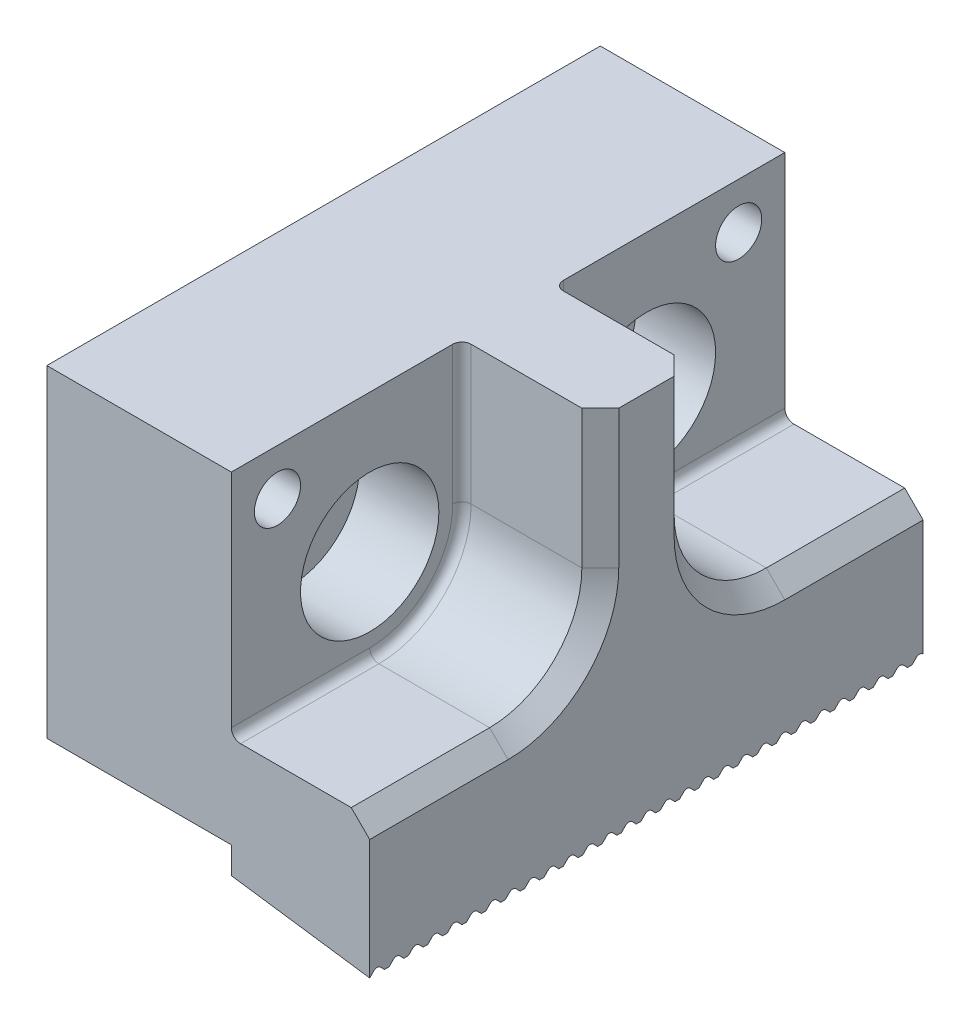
SolidWorks part; units mm, degrees
ref_plane "前视基准面" through (0, 0, 0) normal (0, 0, 1) x (1, 0, 0)
ref_plane "上视基准面" through (0, 0, 0) normal (0, 1, 0) x (1, 0, 0)
ref_plane "右视基准面" through (0, 0, 0) normal (1, 0, 0) x (0, 0, -1)
other "Configuration Table"
sketch "草图1" plane through (0, 0, 0) normal (0, 0, 1) x (1, 0, 0)
  line L0 (-10.4354, -13.2525) -> (-10.4354, 21.7475)
  line L1 (-10.4354, 21.7475) -> (24.5646, 21.7475)
  line L2 (24.5646, 21.7475) -> (24.5646, -18.2525)
  line L3 (24.5646, -18.2525) -> (9.5646, -16.1444)
  line L4 (9.5646, -16.1444) -> (9.5646, -13.2525)
  line L5 (9.5646, -13.2525) -> (-10.4354, -13.2525)
  dimension "D1" = 35
  dimension "D2" = 35
  dimension "D3" = 40
  dimension "D4" = 8
  dimension "D5" = 15
extrude "凸台-拉伸1" add sketch "草图1" along normal blind 60
sketch "草图2" plane through (24.5646, 0, 0) normal (1, 0, 0) x (0, 0, -1)
  line L1 (-60, 21.7475) -> (-35, 21.7475)
  line L2 (-60, 21.7475) -> (-60, -3.2525)
  line L3 (-60, -3.2525) -> (-45, -3.2525)
  line L4 (-35, 21.7475) -> (-35, 6.7475)
  line L5 (0, 21.7475) -> (-25, 21.7475)
  line L6 (0, 21.7475) -> (0, -3.2525)
  line L7 (0, -3.2525) -> (-15, -3.2525)
  line L8 (-25, 21.7475) -> (-25, 6.7475)
  arc A0 (-15, -3.2525) -> (-25, 6.7475) centre (-15, 6.7475) cw
  arc A1 (-45, -3.2525) -> (-35, 6.7475) centre (-45, 6.7475) ccw
  point P12 (-25, -3.2525)
  dimension "D5" = 10
  dimension "D1" = 10
  dimension "D2" = 25
  dimension "D3" = 25
  dimension "D4" = 25
extrude "切除-拉伸1" cut sketch "草图2" against normal blind 15
sketch "草图3" plane through (9.5646, 0, 0) normal (1, 0, 0) x (0, 0, -1)
  line L0 (0, -3.2525) -> (0, 21.7475) construction
  line L1 (-15, -3.2525) -> (0, -3.2525) construction
  line L2 (-25, 21.7475) -> (-25, 6.7475) construction
  line L3 (0, 21.7475) -> (-25, 21.7475) construction
  line L4 (0, -3.2525) -> (0, 21.7475) construction
  line L5 (-15, -3.2525) -> (0, -3.2525) construction
  line L6 (-25, 21.7475) -> (-25, 6.7475) construction
  line L7 (0, 21.7475) -> (-25, 21.7475) construction
  line L12 (-60, 21.7475) -> (-60, -3.2525)
  line L13 (-60, -3.2525) -> (-45, -3.2525)
  line L14 (-35, 6.7475) -> (-35, 21.7475)
  line L15 (-35, 21.7475) -> (-60, 21.7475)
  line L16 (-60, 21.7475) -> (-60, -3.2525) construction
  line L17 (-60, -3.2525) -> (-45, -3.2525) construction
  line L18 (-35, 6.7475) -> (-35, 21.7475) construction
  line L19 (-35, 21.7475) -> (-60, 21.7475) construction
  arc A0 (-25, 6.7475) -> (-15, -3.2525) centre (-15, 6.7475) ccw construction
  arc A1 (-25, 6.7475) -> (-15, -3.2525) centre (-15, 6.7475) ccw construction
  arc A3 (-45, -3.2525) -> (-35, 6.7475) centre (-45, 6.7475) ccw
  arc A4 (-45, -3.2525) -> (-35, 6.7475) centre (-45, 6.7475) ccw construction
  dimension "D1" = 0
hole_wizard "M8 六角凹头螺钉的柱形沉头孔1" positions "3D草图1" profile "草图4" counterbore size "M8" standard "ISO"
sketch3d "3D草图1"
  point P0 (9.5646, 6.7475, 15)
  point P3 (9.5646, 6.7475, 45)
sketch "草图4" plane through (9.5646, 6.7475, 15) normal (0, 1, 0) x (0, 0, -1)
  line L0 (0, 0) -> (0, 20)
  line L1 (0, 20) -> (4.5, 20)
  line L3 (4.5, 20) -> (4.5, 8.6)
  line L4 (4.5, 8.6) -> (7.5, 8.6)
  line L5 (7.5, 8.6) -> (7.5, 0)
  line L7 (7.5, 0) -> (0, 0)
  line L11 (0, -6.35) -> (0, 107.95) construction
  dimension "通孔孔直径" = 9
  dimension "通孔孔深度" = 20
  dimension "柱形沉头孔直径" = 15
  dimension "柱形沉头孔深度" = 8.6
hole_wizard "M6 螺纹孔的螺纹孔钻头1" positions "3D草图2" profile "草图5" hole size "M6" standard "ISO"
sketch3d "3D草图2"
  line L0 (9.5646, 21.7475, 0) -> (9.5646, 21.7475, 25) construction
  line L1 (9.5646, 21.7475, 60) -> (9.5646, -3.2525, 60) construction
  line L2 (9.5646, 21.7475, 35) -> (9.5646, 21.7475, 60) construction
  point P0 (9.5646, 16.7475, 5)
  point P2 (9.5646, 16.7475, 55)
  dimension "D1" = 5
  dimension "D2" = 5
  dimension "D3" = 5
  dimension "D4" = 50
sketch "草图5" plane through (9.5646, 16.7475, 5) normal (0, 1, 0) x (0, 0, -1)
  line L0 (0, 0) -> (0, 20)
  line L1 (0, 20) -> (2.5, 20)
  line L2 (2.5, 20) -> (2.5, 0)
  line L5 (2.5, 0) -> (0, 0)
  line L11 (0, -6.35) -> (0, 107.95) construction
  dimension "通孔孔直径" = 5
  dimension "通孔孔深度" = 20
ref_plane "基准面1" through (26.6043, -3.739, 0) normal (-0.9903, 0.1392, 0) x (0, 0, -1)
sketch "草图6" plane through (26.6043, -3.739, 0) normal (-0.9903, 0.1392, 0) x (0, 0, -1)
  line L0 (-58.4, 14.6561) -> (-60, 14.6561)
  line L1 (-60, 14.6561) -> (0, 14.6561) construction
  line L2 (-58.8464, 14.2097) -> (-58.4, 14.6561)
  line L3 (-59.5536, 14.2097) -> (-60, 14.6561)
  line L4 (-60, 14.6561) -> (-60, -0.1979) construction
  arc A0 (-58.8464, 14.2097) -> (-59.5536, 14.2097) centre (-59.2, 14.5632) cw
  dimension "D2" = 0.5
  dimension "D1" = 0.8
  dimension "D3" = 1.6
  dimension "D4" = 90
sketch "草图7" plane through (24.5646, 0, 0) normal (1, 0, 0) x (0, 0, -1)
  line L3 (-60, -18.2525) -> (-58.4, -18.2525)
  line L4 (-58.4, -18.2525) -> (-58.8464, -17.8017)
  line L5 (-59.5536, -17.8017) -> (-60, -18.2525)
  line L6 (-60, -18.2525) -> (-58.4, -18.2525)
  line L7 (-58.4, -18.2525) -> (-58.8464, -17.8017)
  line L8 (-59.5536, -17.8017) -> (-60, -18.2525)
  ellipse E1 centre (-59.2, -18.1587) end of major axis (-59.2, -18.6636) minor radius 0.5 (-58.8464, -17.8017) -> (-59.5536, -17.8017) ccw
  ellipse E2 centre (-59.2, -18.1587) end of major axis (-59.2, -18.6636) minor radius 0.5 (-58.8464, -17.8017) -> (-59.5536, -17.8017) ccw
  dimension "D1" = 0
extrude "切除-拉伸2" cut sketch "草图7" along direction (-0.9903, 0.1392, 0) on the side against the normal up to next (15 mm away)
pattern_linear "阵列(线性)1" count 29 spacing 2.1 along (0, 0, -1) of "切除-拉伸2"
chamfer "倒角1" distance 2 angle 45 6 edges at (24.5646, -3.2525, 7.5) (24.5646, -0.3236, 22.0711) (24.5646, 14.2475, 25) (24.5646, -3.2525, 52.5) (24.5646, -0.3236, 37.9289) (24.5646, 14.2475, 35)
fillet "圆角1" radius 1 6 edges at (9.5646, -3.2525, 7.5) (9.5646, -0.3236, 22.0711) (9.5646, -3.2525, 52.5) (9.5646, -0.3236, 37.9289) (9.5646, 14.2475, 25) (9.5646, 14.2475, 35)
